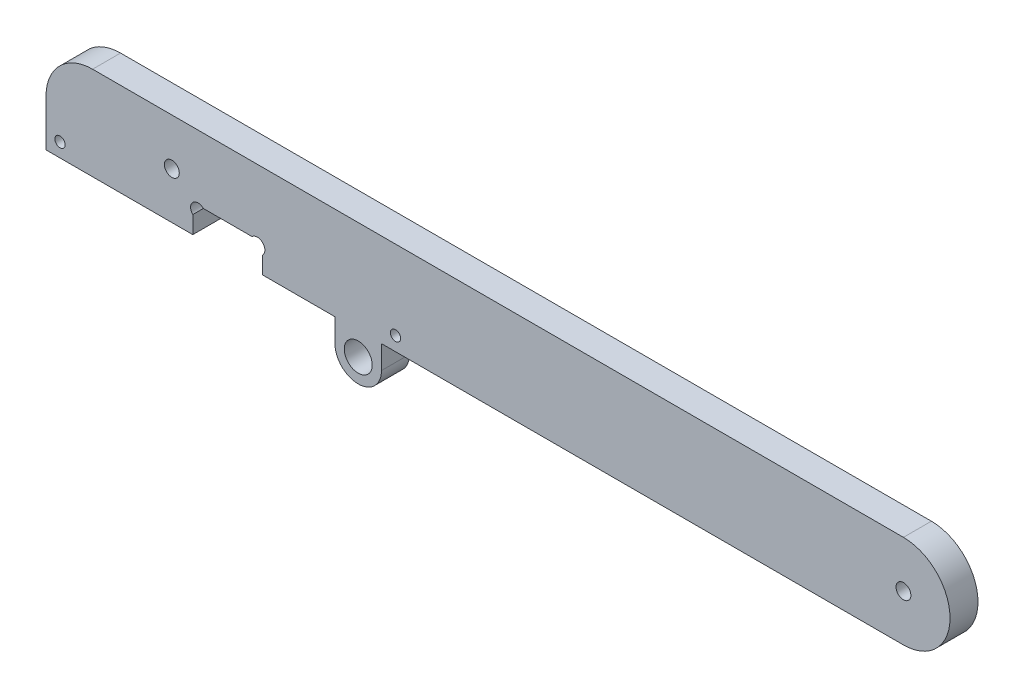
SolidWorks part; units mm, degrees
ref_plane "Plan de face" through (0, 0, 0) normal (0, 0, 1) x (1, 0, 0)
ref_plane "Plan de dessus" through (0, 0, 0) normal (0, 1, 0) x (1, 0, 0)
ref_plane "Plan de droite" through (0, 0, 0) normal (1, 0, 0) x (0, 0, -1)
sketch "Esquisse1" plane through (0, 0, 0) normal (0, 0, 1) x (1, 0, 0)
  line L0 (182.2501, 0) -> (-156.7724, 0) construction
  line L1 (0, -25.2481) -> (0, 63.7295) construction
  line L2 (-140, -20.5495) -> (-140, 96.894) construction
  line L3 (-175.6383, -10) -> (167.9637, -10) construction
  line L4 (-175.6383, 10) -> (167.9637, 10) construction
  line L5 (184, -20.5495) -> (184, 96.894) construction
  line L6 (182.2501, 26) -> (7.9433, 26) construction
  line L7 (0, 0) -> (53.7129, 53.7129) construction
  line L8 (-17.9797, -10.9086) -> (38.7722, 45.8432) construction
  line L9 (-6.3871, -13.4582) -> (53.2982, 46.2271) construction
  line L10 (27, -25.2481) -> (27, 18.7031) construction
  line L11 (4.0635, 21) -> (167.9637, 21) construction
  line L12 (4.0635, 31) -> (167.9637, 31) construction
  line L13 (10, 10) -> (184, 10)
  line L14 (0, -10) -> (31.5, -10)
  line L15 (67, -25.2481) -> (67, 8.4567) construction
  line L16 (72, 8.4567) -> (72, -18.497) construction
  line L17 (92.7095, -15) -> (60.4183, -15) construction
  line L18 (72, -10) -> (184, -10)
  line L19 (72, -15) -> (72, -10)
  line L20 (62, -15) -> (62, -10)
  line L21 (-13.6466, -4) -> (81.3883, -4) construction
  line L22 (-4.0177, -7) -> (81.3883, -7) construction
  line L23 (78, -18.497) -> (78, -1.7263) construction
  line L24 (29.56, 18.7031) -> (29.56, -8.6556) construction
  line L25 (64.44, 18.7031) -> (64.44, -8.6556) construction
  line L26 (3, -15) -> (3, -5.3906) construction
  line L27 (39, -5.3906) -> (39, -20.5495) construction
  line L28 (75, -12.546) -> (75, -5.3906) construction
  line L29 (46.5, -21.3485) -> (46.5, -1.7263) construction
  line L30 (46.5, -4) -> (35.0184, -15.4816) construction
  line L31 (33.7627, -4) -> (44.2373, -4)
  line L32 (46.5, -6.2627) -> (46.5, -10)
  line L33 (31.5, -6.2627) -> (31.5, -10)
  line L34 (0, 0) -> (0, -10)
  line L35 (46.5, -10) -> (62, -10)
  circle A0 centre (27, 0) radius 10 construction
  circle A1 centre (26, 26) radius 5 construction
  circle A2 centre (3, -7) radius 1.1
  arc A3 (184, -10) -> (184, 10) centre (184, 0) ccw
  circle A4 centre (27, 0) radius 1.6
  circle A5 centre (184, 0) radius 1.6
  arc A6 (62, -15) -> (72, -15) centre (67, -15) ccw
  circle A7 centre (67, -15) radius 3
  arc A8 (0, 0) -> (10, 10) centre (10, 0) cw
  circle A9 centre (75, -7) radius 1.1
  arc A10 (46.5, -6.2627) -> (44.2373, -4) centre (45.3686, -5.1314) ccw
  arc A11 (31.5, -6.2627) -> (33.7627, -4) centre (32.6314, -5.1314) cw
  point P84 (0, 10)
  dimension "D12" = 40
  dimension "D15" = 6
  dimension "D18" = 2.56
  dimension "D21" = 39
  dimension "D20" = 3
  dimension "D22" = 3
  dimension "D25" = 10
  dimension "D1" = 140
  dimension "D2" = 10
  dimension "D3" = 20
  dimension "D4" = 324
  dimension "D5" = 26
  dimension "D6" = 135
  dimension "D7" = 5
  dimension "D8" = 5
  dimension "D9" = 10
  dimension "D10" = 5
  dimension "D11" = 27
  dimension "D13" = 5
  dimension "D14" = 5
  dimension "D16" = 3
  dimension "D17" = 6
  dimension "D19" = 34.88
  dimension "D23" = 7.5
  dimension "D24" = 45
extrude "Boss.-Extru.1" add sketch "Esquisse1" along normal blind 6
